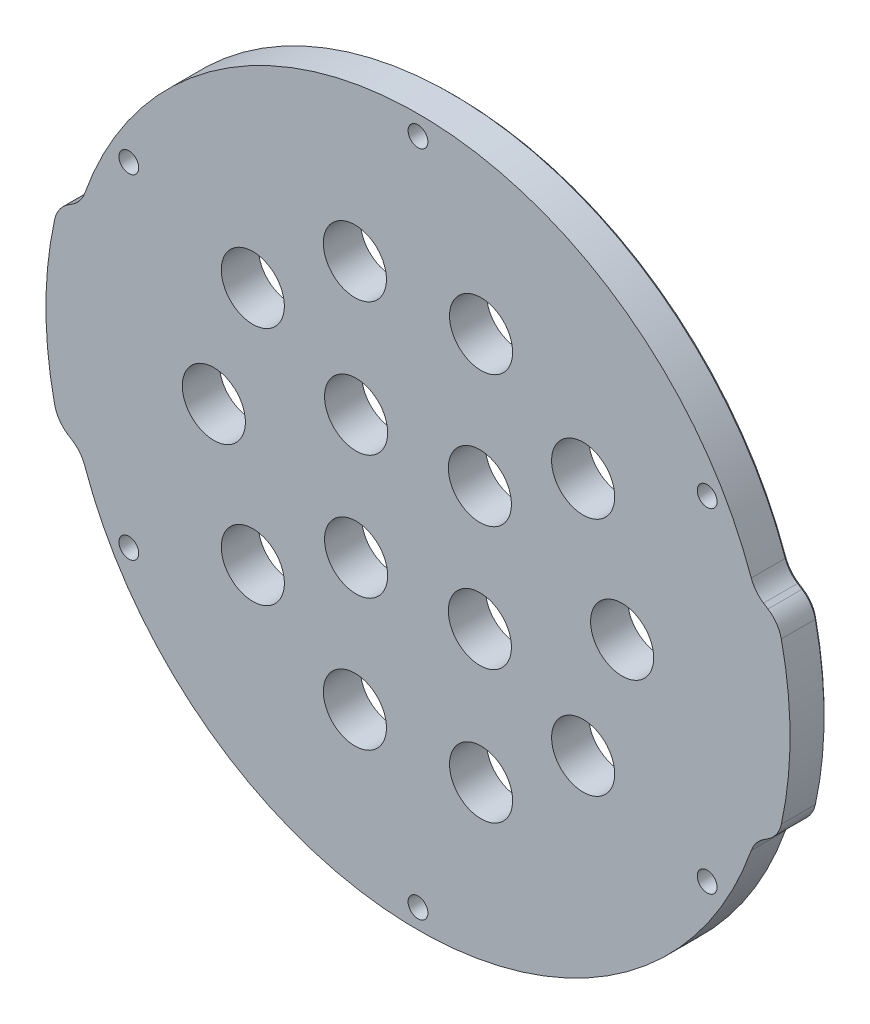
SolidWorks part; units mm, degrees
ref_plane "Front Plane" through (0, 0, 0) normal (0, 0, 1) x (1, 0, 0)
ref_plane "Top Plane" through (0, 0, 0) normal (0, 1, 0) x (1, 0, 0)
ref_plane "Right Plane" through (0, 0, 0) normal (1, 0, 0) x (0, 0, -1)
sketch "Sketch1" plane through (0, 0, 0) normal (0, 0, 1) x (1, 0, 0)
  line L0 (54.4047, 17.5) -> (58.2497, 15)
  line L1 (54.4047, -17.5) -> (58.2497, -15)
  line L2 (-54.4047, 17.5) -> (-58.2497, 15)
  line L3 (-54.4047, -17.5) -> (-58.2497, -15)
  line L4 (0, 53.975) -> (0, 0) construction
  line L5 (0, 0) -> (-46.7437, 26.9875) construction
  line L6 (-46.7437, 26.9875) -> (-49.4934, 28.575) construction
  arc A0 (54.4047, 17.5) -> (-54.4047, 17.5) centre (0, 0) ccw
  circle A1 centre (0, 53.975) radius 1.6
  circle A2 centre (46.7437, 26.9875) radius 1.6
  circle A3 centre (46.7437, -26.9875) radius 1.6
  circle A4 centre (0, -53.975) radius 1.6
  circle A5 centre (-46.7437, -26.9875) radius 1.6
  circle A6 centre (-46.7437, 26.9875) radius 1.6
  arc A7 (58.2497, -15) -> (58.2497, 15) centre (0, 0) ccw
  arc A8 (-58.2497, 15) -> (-58.2497, -15) centre (0, 0) ccw
  arc A9 (-54.4047, -17.5) -> (54.4047, -17.5) centre (0, 0) ccw
  point P17 (0, 0)
  point P26 (-60.15, 0)
  point P27 (60.15, 0)
  dimension "D1" = 114.3
  dimension "D2" = 3.175
  dimension "D3" = 3.2
  dimension "D7" = 3
  dimension "D5" = 35
  dimension "D6" = 30
  dimension "D8" = 60
  dimension "D9" = 3.175
  dimension "D4" = 6
extrude "Boss-Extrude1" add sketch "Sketch1" along normal blind 6
fillet "Fillet1" radius 5 8 edges at (58.2497, -15, 3) (54.4047, -17.5, 3) (58.2497, 15, 3) (54.4047, 17.5, 3) (-54.4047, -17.5, 3) (-58.2497, -15, 3) (-58.2497, 15, 3) (-54.4047, 17.5, 3)
chamfer "Chamfer1" distance 0.5 angle 45 16 edges at (0, -57.15, 0) (54.6578, -17.6514, 0) (-54.6578, -17.6514, 0) (56.2186, -16.3206, 0) (-56.2186, -16.3206, 0) (57.962, -14.7428, 0) (-57.962, -14.7428, 0) (60.15, 0, 0) (-60.15, 0, 0) (57.962, 14.7428, 0) (-57.962, 14.7428, 0) (56.2186, 16.3206, 0) (-56.2186, 16.3206, 0) (54.6578, 17.6514, 0) (-54.6578, 17.6514, 0) (0, 57.15, 0)
sketch "Sketch7" plane through (0, 0, 6) normal (0, 0, 1) x (1, 0, 0)
  circle A0 centre (0, 0) radius 57.15
  circle A1 centre (0, 0) radius 44.45
  arc A2 (53.8721, 19.0768) -> (-53.8721, 19.0768) centre (0, 0) ccw construction
  dimension "D1" = 88.9
extrude "ANALYSIS-SUPPORT" [suppressed] add sketch "Sketch7" along normal blind 1
sketch "Sketch8" plane through (0, 0, 0) normal (0, 0, -1) x (-1, 0, 0)
  circle A0 centre (0, 53.975) radius 2.75
  circle A1 centre (-46.7437, 26.9875) radius 2.75
  circle A2 centre (-46.7437, -26.9875) radius 2.75
  circle A3 centre (0, -53.975) radius 2.75
  circle A4 centre (46.7437, -26.9875) radius 2.75
  circle A5 centre (46.7437, 26.9875) radius 2.75
  dimension "D1" = 5.5
extrude "ANALYSIS-SCREW-HEAD" [suppressed] add sketch "Sketch8" along normal blind 1
sketch "Sketch9" plane through (0, 0, 6) normal (0, 0, 1) x (1, 0, 0)
  circle A0 centre (0, 0.9682) radius 43
  circle A1 centre (0, 0) radius 33
  circle A3 centre (33, 0) radius 5.1
  dimension "D1" = 86
  dimension "D2" = 66
extrude "Cut-Extrude1" cut sketch "Sketch9" against normal blind 10 contours A1 A3 | A1 A3
pattern_circular "CirPattern1" count 10 over 360 about axis through (0, 0, 0) along (0, 0, 1) of "Cut-Extrude1"
sketch "Sketch10" plane through (0, 0, 6) normal (0, 0, 1) x (1, 0, 0)
  line L0 (10.0056, 10.0056) -> (-10.0056, -10.0056)
  line L1 (10.0056, -10.0056) -> (-10.0056, 10.0056)
  line L2 (14.15, 0) -> (-14.15, 0)
  circle A11 centre (0, 0) radius 14.15
  circle A12 centre (-14.15, 0) radius 10
  circle A13 centre (14.15, 0) radius 10
  circle A14 centre (0, 14.15) radius 10
  circle A15 centre (0, -14.15) radius 10
  circle A16 centre (-10.0056, 10.0056) radius 5.1
  dimension "D11" = 28.3
  dimension "D12" = 20
  dimension "D13" = 20
  dimension "D14" = 20
  dimension "D15" = 20
  dimension "D16" = 10.2
  dimension "D17" = 45
  dimension "D18" = 45
extrude "Cut-Extrude2" cut sketch "Sketch10" against normal blind 10 contours A14 A16 A12 A11 | A12 A16 A11 | A11 A16 A12 | A14 A16 A11 | A11 A16 A14 | L1 A16 A14 A11 | A12 A16 L1 A11
pattern_circular "CirPattern2" count 4 over 360 about axis through (0, 0, 0) along (0, 0, 1) of "Cut-Extrude2"
